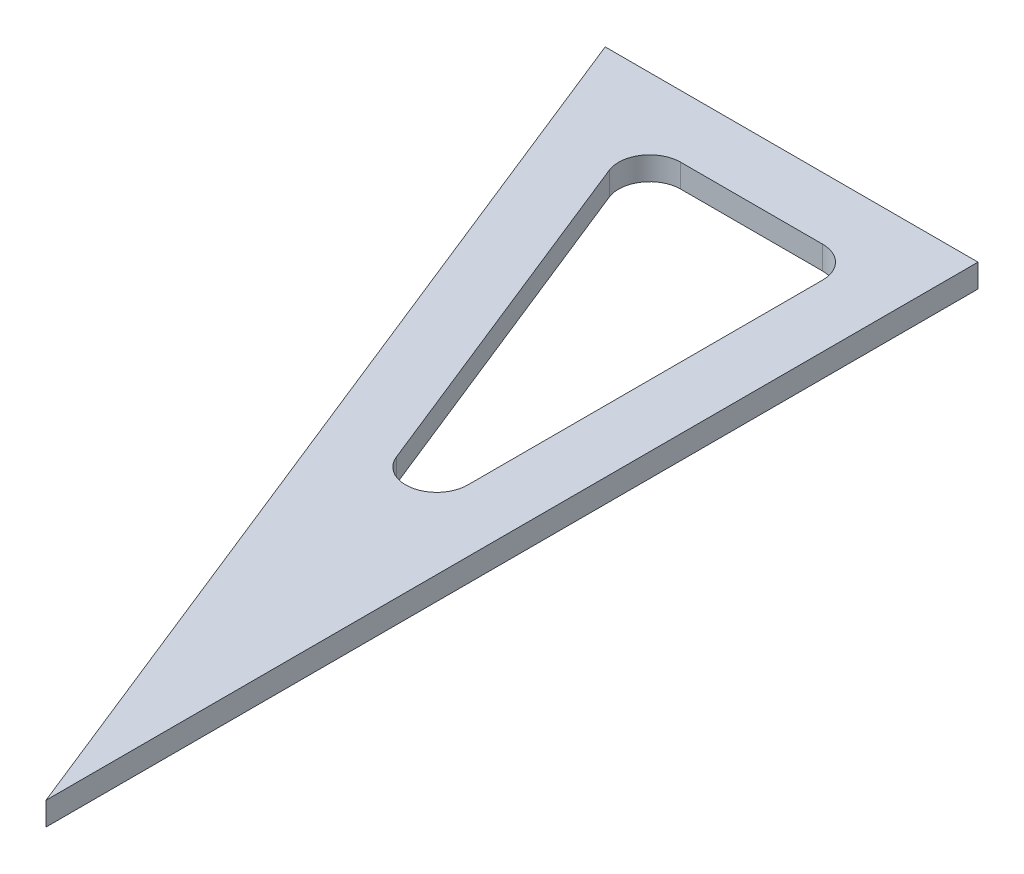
SolidWorks part; units mm, degrees
ref_plane "Front Plane" through (0, 0, 0) normal (0, 0, 1) x (1, 0, 0)
ref_plane "Top Plane" through (0, 0, 0) normal (0, 1, 0) x (1, 0, 0)
ref_plane "Right Plane" through (0, 0, 0) normal (1, 0, 0) x (0, 0, -1)
sketch "Sketch1" plane through (0, 0, 0) normal (0, 0, 1) x (1, 0, 0)
  line L0 (-132.3761, 216.071) -> (133.32, 216.071) construction
  line L1 (-11.3462, 243.2294) -> (-6.5837, 243.2294) construction
  line L2 (-11.3462, 188.9125) -> (-6.5837, 188.9125) construction
  line L3 (-11.3462, 213.0812) -> (-11.3462, 241.9737) construction
  line L4 (-11.3462, 218.4522) -> (-87.5462, 218.4522)
  line L5 (-11.3462, 218.4522) -> (-11.3462, 213.6897)
  line L6 (-11.3462, 213.6897) -> (-87.5462, 213.6897)
  line L7 (-87.5462, 218.4522) -> (-87.5462, 213.6897)
  dimension "D1" = 4.7625
  dimension "D2" = 76.2
extrude "Extrude1" add sketch "Sketch1" along normal blind 190.5
sketch "Sketch2" plane through (0, 218.4522, 0) normal (0, 1, 0) x (1, 0, 0)
  line L0 (-87.5462, 0) -> (-11.3462, -190.5)
  line L1 (-11.3462, -190.5) -> (-87.5462, -190.5)
  line L2 (-87.5462, -190.5) -> (-87.5462, 0)
  line L5 (-68.7879, -12.7) -> (-24.0462, -124.5542)
  line L8 (-24.0462, -190.5) -> (-24.0462, 0)
  line L9 (-24.0462, -124.5542) -> (-24.0462, -12.7)
  line L10 (-75.7546, 4.7167) -> (0.4454, -185.7833) construction
  line L11 (-11.3462, -12.7) -> (-87.5462, -12.7)
  line L12 (-24.0462, -12.7) -> (-68.7879, -12.7)
  dimension "D1" = 12.7
  dimension "D2" = 12.7
  dimension "D3" = 12.7
extrude "Cut-Extrude1" cut sketch "Sketch2" against normal through all
fillet "Fillet1" radius 6.35 3 edges at (-24.0462, 216.071, 124.5542) (-24.0462, 216.071, 12.7) (-68.7879, 216.071, 12.7)
